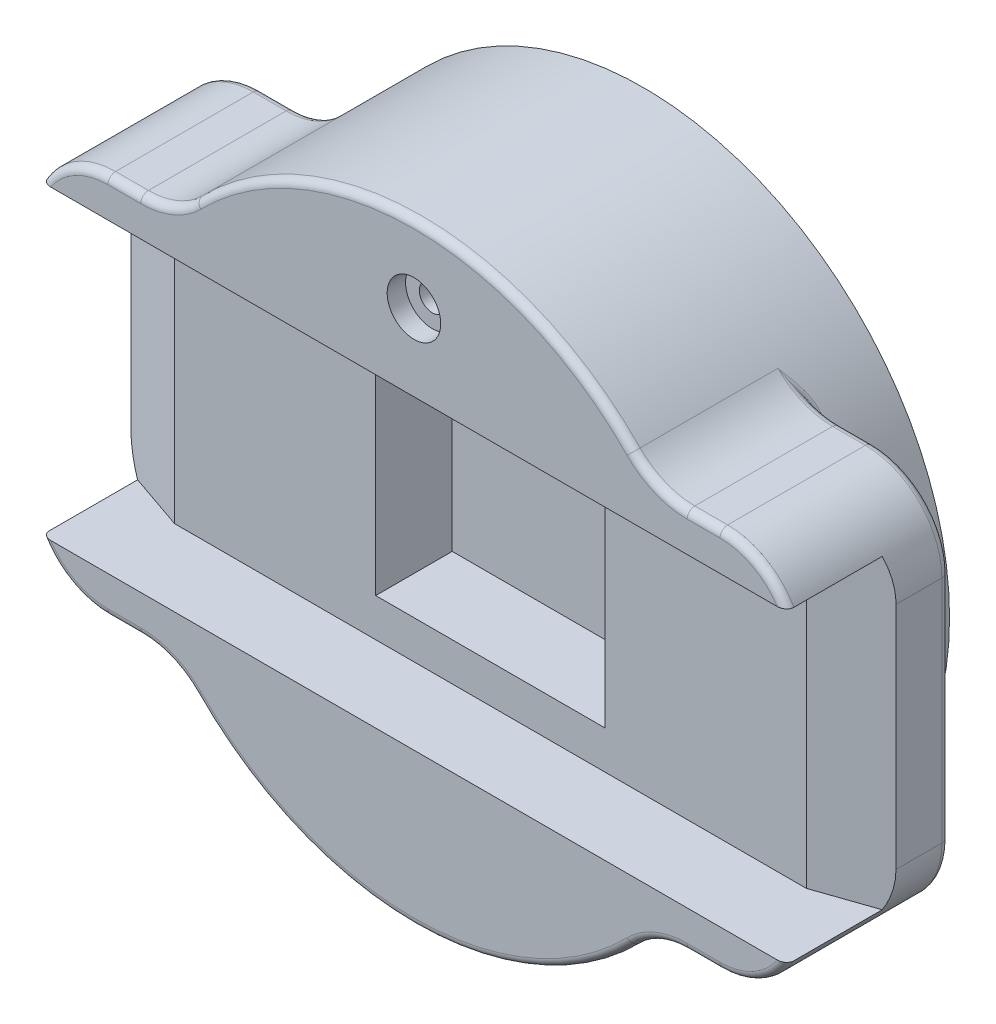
SolidWorks part; units mm, degrees
ref_plane "Front Plane" through (0, 0, 0) normal (0, 0, 1) x (1, 0, 0)
ref_plane "Top Plane" through (0, 0, 0) normal (0, 1, 0) x (1, 0, 0)
ref_plane "Right Plane" through (0, 0, 0) normal (1, 0, 0) x (0, 0, -1)
sketch "Sketch1" plane through (0, 0, 0) normal (0, 0, 1) x (1, 0, 0)
  circle A0 centre (0, 0) radius 40
  dimension "D1" = 80
extrude "Boss-Extrude1" add sketch "Sketch1" along normal blind 20
sketch "Sketch2" plane through (0, 0, 0) normal (0, 0, -1) x (-1, 0, 0)
  line L1 (-15, 15) -> (15, 15)
  line L2 (-15, 15) -> (-15, -15)
  line L3 (-15, -15) -> (15, -15)
  line L4 (15, 15) -> (15, -15)
  line L5 (-15, 15) -> (15, -15) construction
  line L6 (-15, -15) -> (15, 15) construction
  point P0 (0, 0)
  dimension "D1" = 30
  dimension "D2" = 30
extrude "Boss-Extrude2" add sketch "Sketch2" along normal blind 10
sketch "Sketch3" plane through (0, 0, 20) normal (0, 0, 1) x (1, 0, 0)
  line L1 (-50, -25) -> (50, -25)
  line L2 (-50, -25) -> (-50, 25)
  line L3 (-50, 25) -> (50, 25)
  line L4 (50, -25) -> (50, 25)
  line L5 (-50, -25) -> (50, 25) construction
  line L6 (-50, 25) -> (50, -25) construction
  point P0 (0, 0)
  dimension "D1" = 50
  dimension "D2" = 100
extrude "Boss-Extrude3" add sketch "Sketch3" against normal blind 10
sketch "Sketch4" plane through (0, 0, 20) normal (0, 0, 1) x (1, 0, 0)
  line L0 (-50, -14.1475) -> (-50, -25)
  line L1 (-50, -20) -> (50, -20)
  line L3 (-50, 20) -> (50, 20)
  line L5 (-70.6839, -20) -> (70.6839, 20) construction
  line L6 (-31.225, 25) -> (-50, 25)
  line L7 (-50, 25) -> (-50, -25)
  line L8 (-50, -25) -> (-31.225, -25)
  line L9 (31.225, -25) -> (50, -25)
  line L10 (50, -25) -> (50, 25)
  line L11 (50, 25) -> (31.225, 25)
  line L12 (-31.225, 25) -> (-50, 25)
  line L13 (-50, 25) -> (-50, 14.1475)
  line L14 (-50, -25) -> (-31.225, -25)
  line L15 (31.225, -25) -> (50, -25)
  line L16 (50, -25) -> (50, -14.1475)
  line L17 (50, 25) -> (31.225, 25)
  line L18 (-70.6839, 20) -> (50, -14.1475) construction
  line L23 (-96.6746, -55.7232) -> (96.6746, 55.7232) construction
  line L24 (-96.6746, 55.7232) -> (96.6746, -55.7232) construction
  line L25 (50, 20) -> (50, 25)
  arc A2 (31.225, 25) -> (-31.225, 25) centre (0, 0) ccw
  arc A3 (-31.225, -25) -> (31.225, -25) centre (0, 0) ccw
  arc A4 (31.225, 25) -> (-31.225, 25) centre (0, 0) ccw
  arc A5 (-31.225, -25) -> (31.225, -25) centre (0, 0) ccw
  dimension "D2" = 5
  dimension "D3" = 5
  dimension "D1" = 0
extrude "Boss-Extrude4" add sketch "Sketch4" along normal blind 10 contours L3 M19 M23 M24 M17 M18 | L1 L0 M20 M21 M22 M23
sketch "Sketch5" plane through (0, 0, 20) normal (0, 0, 1) x (1, 0, 0)
  line L4 (-15, 15) -> (-15, -15)
  line L5 (15, 15) -> (-15, 15)
  line L6 (15, -15) -> (15, 15)
  line L7 (-15, -15) -> (15, -15)
  line L8 (-15, 15) -> (-15, -15)
  line L9 (15, 15) -> (-15, 15)
  line L10 (15, -15) -> (15, 15)
  line L11 (-15, -15) -> (15, -15)
  dimension "D1" = 0
extrude "Cut-Extrude1" cut sketch "Sketch5" against normal blind 10
sketch "Sketch6" plane through (0, 0, 30) normal (0, 0, 1) x (1, 0, 0)
  line L0 (0, -20) -> (0, 30) construction
  line L1 (-50, -20) -> (50, -20) construction
  circle A0 centre (0, 30) radius 1.5
  dimension "D1" = 3
  dimension "D2" = 50
hole_wizard "CBORE for M3 Pan Head Screw1" positions "3DSketch1" profile "Sketch7" counterbore size "M3" standard "ISO"
sketch3d "3DSketch1"
  point P0 (0, 30, 30)
sketch "Sketch7" plane through (0, 30, 30) normal (1, 0, 0) x (0, -1, 0)
  line L0 (0, 0) -> (0, 30)
  line L1 (0, 30) -> (1.7, 30)
  line L3 (1.7, 30) -> (1.7, 2.4)
  line L4 (1.7, 2.4) -> (3.5, 2.4)
  line L5 (3.5, 2.4) -> (3.5, 0)
  line L7 (3.5, 0) -> (0, 0)
  line L11 (0, -6.35) -> (0, 107.95) construction
  dimension "Thru Hole Dia." = 3.4
  dimension "Thru Hole Depth" = 30
  dimension "C'Bore Dia." = 7
  dimension "C'Bore Depth" = 2.4
chamfer "Chamfer1" distance 3 angle 71 2 edges at (50, 0, 20) (-50, 0, 20)
fillet "Fillet2" radius 10 16 edges at (50, -25, 20) (-50, 25, 20) (50, 25, 20) (-31.225, -25, 20) (31.225, -25, 20) (-50, -25, 20) (31.225, 25, 20) (-31.225, 25, 20) (-50, 20, 23.5) (50, 20, 23.5) (-50, 22.5, 30) (50, 22.5, 30) (50, -20, 23.5) (-50, -20, 23.5) (-50, -22.5, 30) (50, -22.5, 30)
fillet "Fillet3" radius 1 28 edges at (-45, -23.6603, 30) (-37.8536, -25, 30) (45, -23.6603, 30) (37.8536, -25, 30) (31.8342, -25.7805, 30) (0, -40, 30) (45, 23.6603, 30) (37.8536, 25, 30) (31.8342, 25.7805, 30) (-45, 23.6603, 30) (-37.8536, 25, 30) (-31.8342, 25.7805, 30) (-31.8342, -25.7805, 10) (-40, 0, 10) (-31.8342, 25.7805, 10) (37.8536, 25, 10) (-47.0711, 22.0711, 10) (-50, 0, 10) (-47.0711, -22.0711, 10) (37.8536, -25, 10) (47.0711, 22.0711, 10) (31.8342, 25.7805, 10) (40, 0, 10) (31.8342, -25.7805, 10) (47.0711, -22.0711, 10) (50, 0, 10) (-31.8342, -25.7805, 30) (0, 40, 30)
